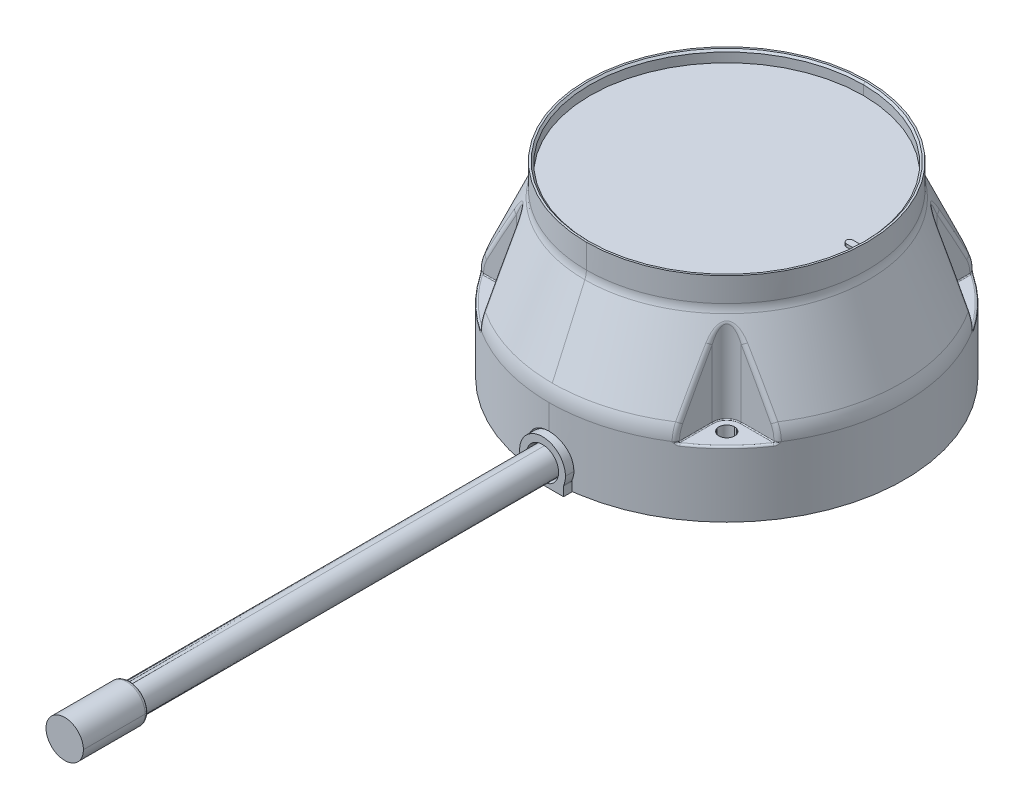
SolidWorks part; units mm, degrees
ref_plane "前视基准面" through (0, 0, 0) normal (0, 0, 1) x (1, 0, 0)
ref_plane "上视基准面" through (0, 0, 0) normal (0, 1, 0) x (1, 0, 0)
ref_plane "右视基准面" through (0, 0, 0) normal (1, 0, 0) x (0, 0, -1)
imported_body "输入1"
imported_body "输入2"
imported_body "输入3"
imported_body "输入4"
imported_body "输入5"
imported_body "输入6"
imported_body "输入7"
imported_body "输入8"
imported_body "输入9"
ref_plane "基准面2" through (0, 0, 319) normal (0, 0, -1) x (-1, 0, 0)
split "分割1" trim tools "基准面2" bodies to split 108 resulting bodies 115 116
